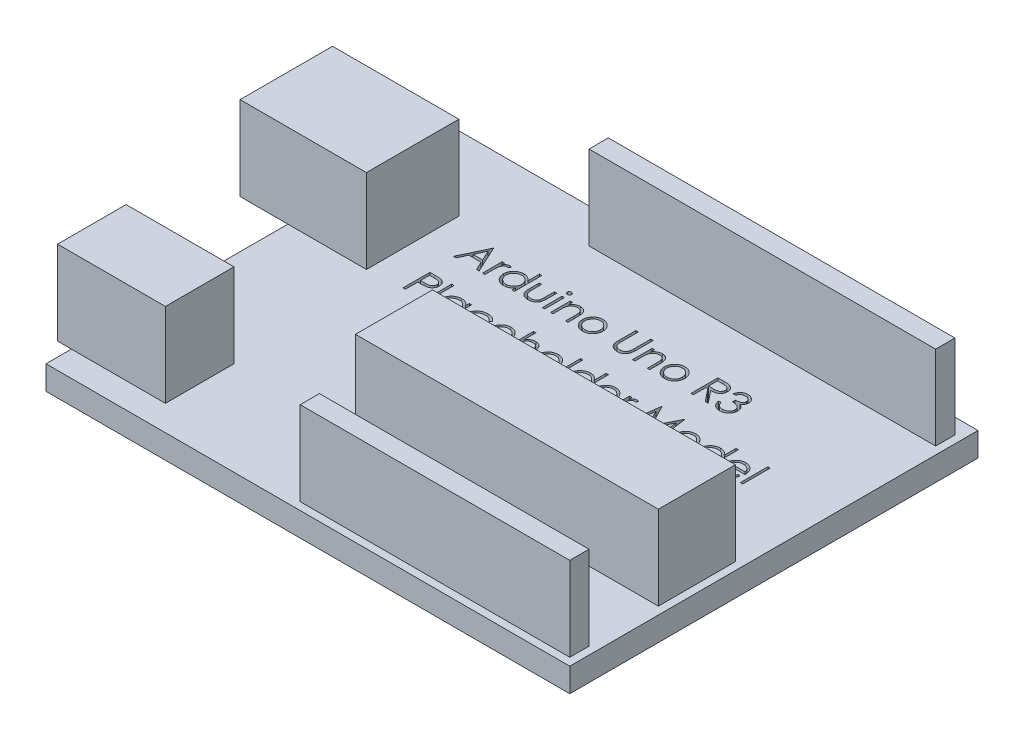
SolidWorks part; units mm, degrees
ref_plane "Front Plane" through (0, 0, 0) normal (0, 0, 1) x (1, 0, 0)
ref_plane "Top Plane" through (0, 0, 0) normal (0, 1, 0) x (1, 0, 0)
ref_plane "Right Plane" through (0, 0, 0) normal (1, 0, 0) x (0, 0, -1)
sketch "Sketch2" plane through (0, 0, 0) normal (0, 1, 0) x (1, 0, 0)
  line L1 (34, -26.5) -> (-34, -26.5)
  line L2 (34, -26.5) -> (34, 26.5)
  line L3 (34, 26.5) -> (-34, 26.5)
  line L4 (-34, -26.5) -> (-34, 26.5)
  line L5 (34, -26.5) -> (-34, 26.5) construction
  line L6 (34, 26.5) -> (-34, -26.5) construction
  point P0 (0, 0)
  dimension "D1" = 68
  dimension "D2" = 53
extrude "Boss-Extrude1" add sketch "Sketch2" along normal blind 3.1
sketch "Sketch3" plane through (0, 3.1, 0) normal (0, 1, 0) x (1, 0, 0)
  line L0 (-34, 26.5) -> (-34, -26.5) construction
  line L1 (-27.8, 4.9) -> (-40.2, 4.9)
  line L2 (-27.8, 4.9) -> (-27.8, 16.9)
  line L3 (-27.8, 16.9) -> (-40.2, 16.9)
  line L4 (-40.2, 4.9) -> (-40.2, 16.9)
  line L5 (-27.8, 4.9) -> (-40.2, 16.9) construction
  line L6 (-27.8, 16.9) -> (-40.2, 4.9) construction
  line L7 (34, -26.5) -> (34, 26.5) construction
  line L8 (33, 22) -> (-12, 22)
  line L9 (33, 22) -> (33, 24.5)
  line L10 (33, 24.5) -> (-12, 24.5)
  line L11 (-12, 22) -> (-12, 24.5)
  line L12 (33, 22) -> (-12, 24.5) construction
  line L13 (33, 24.5) -> (-12, 22) construction
  line L14 (33, -25.5) -> (-2, -25.5)
  line L15 (33, -25.5) -> (33, -23)
  line L16 (33, -23) -> (-2, -23)
  line L17 (-2, -25.5) -> (-2, -23)
  line L18 (33, -25.5) -> (-2, -23) construction
  line L19 (33, -23) -> (-2, -25.5) construction
  line L20 (33, -4) -> (-6.3212, -4)
  line L21 (33, -4) -> (33, -14)
  line L22 (33, -14) -> (-6.3212, -14)
  line L23 (-6.3212, -4) -> (-6.3212, -14)
  line L24 (33, -4) -> (-6.3212, -14) construction
  line L25 (33, -14) -> (-6.3212, -4) construction
  line L26 (-34, -26.5) -> (34, -26.5) construction
  line L27 (34, 26.5) -> (-34, 26.5) construction
  line L28 (-27.8, 16.9) -> (-23.8, 16.9)
  line L29 (-21.8, -23.2) -> (-35.8, -23.2)
  line L30 (-21.8, -23.2) -> (-21.8, -14.3)
  line L31 (-21.8, -14.3) -> (-35.8, -14.3)
  line L32 (-35.8, -23.2) -> (-35.8, -14.3)
  line L33 (-21.8, -23.2) -> (-35.8, -14.3) construction
  line L34 (-21.8, -14.3) -> (-35.8, -23.2) construction
  line L35 (-23.8, 16.9) -> (-23.8, 4.9)
  line L36 (-23.8, 4.9) -> (-27.8, 4.9)
  line L37 (-27.8, 16.9) -> (-27.8, 4.9)
  point P0 (-34, 10.9)
  point P7 (10.5, 23.25)
  point P13 (15.5, -24.25)
  point P18 (13.3394, -9)
  point P31 (-28.8, -18.75)
  dimension "D1" = 6.2
  dimension "D2" = 9.6
  dimension "D3" = 12
  dimension "D4" = 2.5
  dimension "D5" = 35
  dimension "D6" = 1
  dimension "D7" = 1
  dimension "D8" = 1
  dimension "D9" = 1
  dimension "D10" = 45
  dimension "D11" = 2.5
  dimension "D12" = 2
  dimension "D13" = 10
  dimension "D14" = 9
  dimension "D15" = 1.8
  dimension "D16" = 8.9
  dimension "D17" = 3.3
  dimension "D18" = 4
  dimension "D19" = 14
extrude "Boss-Extrude2" add sketch "Sketch3" along normal blind 10.9 contours L4 L1 L3 M6 | L2 L3 L1 M6 | L36 L35 L28 L2 | L30 L31 L29 M6 | L32 L29 L31 M6 | L20 L23 L22 L21 | L17 L14 L15 L16 | L11 L8 L9 L10
sketch "Sketch4" plane through (0, 3.1, 0) normal (0, 1, 0) x (1, 0, 0)
  text T0 "Arduino Uno R3  Placeholder Model"
extrude "Cut-Extrude1" cut sketch "Sketch4" against normal blind 5
